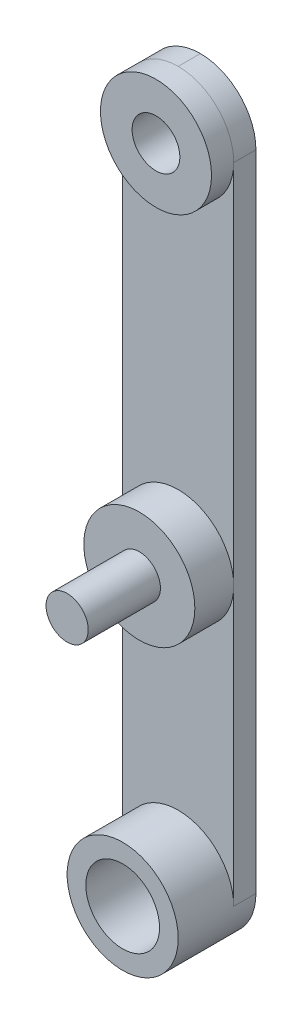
SolidWorks part; units mm, degrees
ref_plane "Plan de face" through (0, 0, 0) normal (0, 0, 1) x (1, 0, 0)
ref_plane "Plan de dessus" through (0, 0, 0) normal (0, 1, 0) x (1, 0, 0)
ref_plane "Plan de droite" through (0, 0, 0) normal (1, 0, 0) x (0, 0, -1)
sketch "Esquisse1" plane through (0, 0, 0) normal (0, 0, 1) x (1, 0, 0)
  line L0 (0, 57.8302) -> (0, -54.6226) construction
  line L1 (-12.0368, -30) -> (22.7958, -30) construction
  line L2 (-5, 38) -> (5, 38)
  line L3 (-5, 38) -> (-5, -25)
  line L5 (5, 38) -> (5, -25)
  arc A0 (-5, -25) -> (5, -25) centre (0, -25) ccw
  dimension "D1" = 10
  dimension "D2" = 30
  dimension "D3" = 38
extrude "Boss.-Extru.1" add sketch "Esquisse1" along normal blind 2
sketch "Esquisse2" plane through (0, 0, 2) normal (0, 0, 1) x (1, 0, 0)
  circle A0 centre (0, 0) radius 1.9
  dimension "D2" = 3.8
extrude "Boss.-Extru.2" add sketch "Esquisse2" along normal blind 10
sketch "Esquisse3" plane through (0, 0, 2) normal (0, 0, 1) x (1, 0, 0)
  line L0 (5, 38) -> (5, -25) construction
  circle A0 centre (0, 0) radius 5
extrude "Boss.-Extru.3" add sketch "Esquisse3" along normal blind 3.5
sketch "Esquisse4" plane through (0, 0, 2) normal (0, 0, 1) x (1, 0, 0)
  circle A0 centre (0, 33) radius 5
  dimension "D1" = 33
extrude "Boss.-Extru.5" add sketch "Esquisse4" along normal blind 2 contours A0
sketch "Esquisse5" plane through (0, 0, 4) normal (0, 0, 1) x (1, 0, 0)
  circle A0 centre (0, 33) radius 2.15
  dimension "D1" = 4.3
extrude "Enlèv. mat.-Extru.1" cut sketch "Esquisse5" against normal through all
fillet "Congé1" radius 5 2 edges at (5, 38, 1) (-5, 38, 1)
sketch "Esquisse6" plane through (0, 0, 2) normal (0, 0, 1) x (1, 0, 0)
  circle A0 centre (0, -25) radius 5
extrude "Boss.-Extru.6" add sketch "Esquisse6" along normal blind 5
sketch "Esquisse7" plane through (0, 0, 7) normal (0, 0, 1) x (1, 0, 0)
  circle A0 centre (0, -25) radius 3.3187
extrude "Enlèv. mat.-Extru.2" cut sketch "Esquisse7" against normal through all
